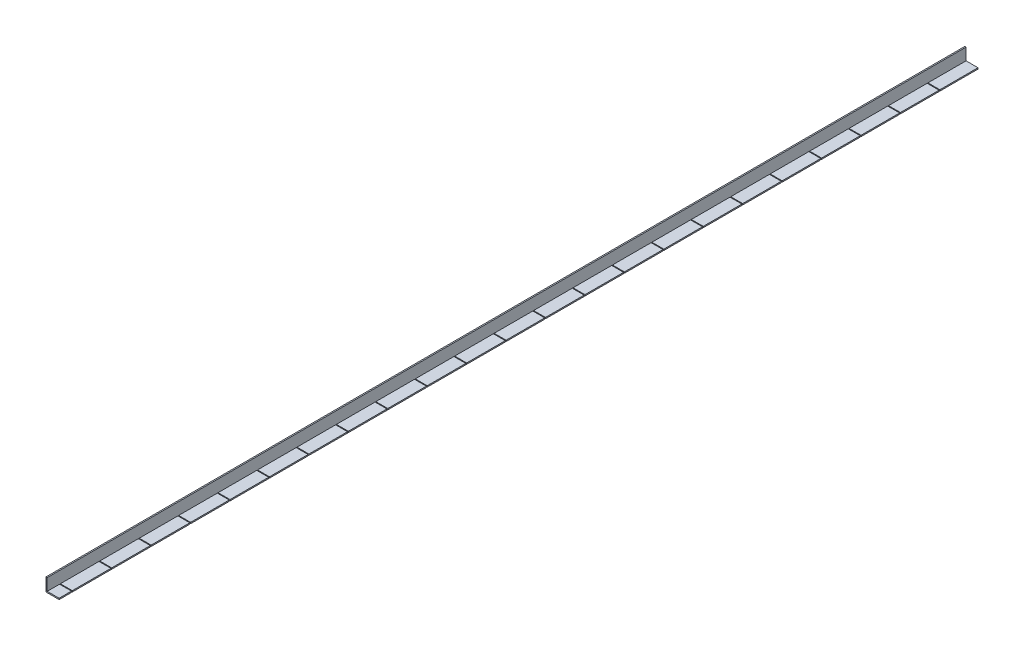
SolidWorks part; units mm, degrees
ref_plane "Front Plane" through (0, 0, 0) normal (0, 0, 1) x (1, 0, 0)
ref_plane "Top Plane" through (0, 0, 0) normal (0, 1, 0) x (1, 0, 0)
ref_plane "Right Plane" through (0, 0, 0) normal (1, 0, 0) x (0, 0, -1)
ref_plane "Plane1" through (0, 0, 0) normal (-1, 0, 0) x (0, -1, 0)
sketch "Sketch1" plane through (0, 0, 0) normal (-1, 0, 0) x (0, -1, 0)
  line L0 (-50.8, 0) -> (0, 0)
  line L1 (0, 0) -> (0, 3550.92)
  line L2 (0, 3550.92) -> (-50.8, 3550.92)
  line L3 (-50.8, 3550.92) -> (-50.8, 0)
extrude "Boss-Extrude1" add sketch "Sketch1" against normal blind 4.7625
sketch "Sketch2" plane through (4.7625, 0, 0) normal (1, 0, 0) x (0, 0, -1)
  line L0 (-3503.295, 4.7625) -> (-3503.295, 0)
  line L1 (-3503.295, 0) -> (-3550.92, 0)
  line L2 (-3550.92, 0) -> (-3550.92, 4.7625)
  line L3 (-3550.92, 4.7625) -> (-3503.295, 4.7625)
extrude "Boss-Extrude2" add sketch "Sketch2" along normal blind 46.0375
sketch "Sketch3" plane through (4.7625, 0, 0) normal (1, 0, 0) x (0, 0, -1)
  line L0 (-147.32, 0) -> (-147.32, 4.7625)
  line L1 (-147.32, 4.7625) -> (0, 4.7625)
  line L2 (0, 4.7625) -> (0, 0)
  line L3 (0, 0) -> (-147.32, 0)
extrude "Boss-Extrude3" add sketch "Sketch3" along normal blind 46.0375
sketch "Sketch4" plane through (4.7625, 0, 0) normal (1, 0, 0) x (0, 0, -1)
  line L0 (-3500.12, 0) -> (-3500.12, 4.7625)
  line L1 (-3500.12, 4.7625) -> (-3350.895, 4.7625)
  line L2 (-3350.895, 4.7625) -> (-3350.895, 0)
  line L3 (-3350.895, 0) -> (-3500.12, 0)
extrude "Boss-Extrude4" add sketch "Sketch4" along normal blind 46.0375
sketch "Sketch5" plane through (4.7625, 0, 0) normal (1, 0, 0) x (0, 0, -1)
  line L0 (-3347.72, 0) -> (-3347.72, 4.7625)
  line L1 (-3347.72, 4.7625) -> (-3198.495, 4.7625)
  line L2 (-3198.495, 4.7625) -> (-3198.495, 0)
  line L3 (-3198.495, 0) -> (-3347.72, 0)
extrude "Boss-Extrude5" add sketch "Sketch5" along normal blind 46.0375
sketch "Sketch6" plane through (4.7625, 0, 0) normal (1, 0, 0) x (0, 0, -1)
  line L0 (-3195.32, 0) -> (-3195.32, 4.7625)
  line L1 (-3195.32, 4.7625) -> (-3046.095, 4.7625)
  line L2 (-3046.095, 4.7625) -> (-3046.095, 0)
  line L3 (-3046.095, 0) -> (-3195.32, 0)
extrude "Boss-Extrude6" add sketch "Sketch6" along normal blind 46.0375
sketch "Sketch7" plane through (4.7625, 0, 0) normal (1, 0, 0) x (0, 0, -1)
  line L0 (-3042.92, 0) -> (-3042.92, 4.7625)
  line L1 (-3042.92, 4.7625) -> (-2893.695, 4.7625)
  line L2 (-2893.695, 4.7625) -> (-2893.695, 0)
  line L3 (-2893.695, 0) -> (-3042.92, 0)
extrude "Boss-Extrude7" add sketch "Sketch7" along normal blind 46.0375
sketch "Sketch8" plane through (4.7625, 0, 0) normal (1, 0, 0) x (0, 0, -1)
  line L0 (-2890.52, 0) -> (-2890.52, 4.7625)
  line L1 (-2890.52, 4.7625) -> (-2741.295, 4.7625)
  line L2 (-2741.295, 4.7625) -> (-2741.295, 0)
  line L3 (-2741.295, 0) -> (-2890.52, 0)
extrude "Boss-Extrude8" add sketch "Sketch8" along normal blind 46.0375
sketch "Sketch9" plane through (4.7625, 0, 0) normal (1, 0, 0) x (0, 0, -1)
  line L0 (-2738.12, 0) -> (-2738.12, 4.7625)
  line L1 (-2738.12, 4.7625) -> (-2588.895, 4.7625)
  line L2 (-2588.895, 4.7625) -> (-2588.895, 0)
  line L3 (-2588.895, 0) -> (-2738.12, 0)
extrude "Boss-Extrude9" add sketch "Sketch9" along normal blind 46.0375
sketch "Sketch10" plane through (4.7625, 0, 0) normal (1, 0, 0) x (0, 0, -1)
  line L0 (-2585.72, 0) -> (-2585.72, 4.7625)
  line L1 (-2585.72, 4.7625) -> (-2436.495, 4.7625)
  line L2 (-2436.495, 4.7625) -> (-2436.495, 0)
  line L3 (-2436.495, 0) -> (-2585.72, 0)
extrude "Boss-Extrude10" add sketch "Sketch10" along normal blind 46.0375
sketch "Sketch11" plane through (4.7625, 0, 0) normal (1, 0, 0) x (0, 0, -1)
  line L0 (-2433.32, 0) -> (-2433.32, 4.7625)
  line L1 (-2433.32, 4.7625) -> (-2284.095, 4.7625)
  line L2 (-2284.095, 4.7625) -> (-2284.095, 0)
  line L3 (-2284.095, 0) -> (-2433.32, 0)
extrude "Boss-Extrude11" add sketch "Sketch11" along normal blind 46.0375
sketch "Sketch12" plane through (4.7625, 0, 0) normal (1, 0, 0) x (0, 0, -1)
  line L0 (-2280.92, 0) -> (-2280.92, 4.7625)
  line L1 (-2280.92, 4.7625) -> (-2131.695, 4.7625)
  line L2 (-2131.695, 4.7625) -> (-2131.695, 0)
  line L3 (-2131.695, 0) -> (-2280.92, 0)
extrude "Boss-Extrude12" add sketch "Sketch12" along normal blind 46.0375
sketch "Sketch13" plane through (4.7625, 0, 0) normal (1, 0, 0) x (0, 0, -1)
  line L0 (-2128.52, 0) -> (-2128.52, 4.7625)
  line L1 (-2128.52, 4.7625) -> (-1979.295, 4.7625)
  line L2 (-1979.295, 4.7625) -> (-1979.295, 0)
  line L3 (-1979.295, 0) -> (-2128.52, 0)
extrude "Boss-Extrude13" add sketch "Sketch13" along normal blind 46.0375
sketch "Sketch14" plane through (4.7625, 0, 0) normal (1, 0, 0) x (0, 0, -1)
  line L0 (-1976.12, 0) -> (-1976.12, 4.7625)
  line L1 (-1976.12, 4.7625) -> (-1826.895, 4.7625)
  line L2 (-1826.895, 4.7625) -> (-1826.895, 0)
  line L3 (-1826.895, 0) -> (-1976.12, 0)
extrude "Boss-Extrude14" add sketch "Sketch14" along normal blind 46.0375
sketch "Sketch15" plane through (4.7625, 0, 0) normal (1, 0, 0) x (0, 0, -1)
  line L0 (-1823.72, 0) -> (-1823.72, 4.7625)
  line L1 (-1823.72, 4.7625) -> (-1674.495, 4.7625)
  line L2 (-1674.495, 4.7625) -> (-1674.495, 0)
  line L3 (-1674.495, 0) -> (-1823.72, 0)
extrude "Boss-Extrude15" add sketch "Sketch15" along normal blind 46.0375
sketch "Sketch16" plane through (4.7625, 0, 0) normal (1, 0, 0) x (0, 0, -1)
  line L0 (-1671.32, 0) -> (-1671.32, 4.7625)
  line L1 (-1671.32, 4.7625) -> (-1522.095, 4.7625)
  line L2 (-1522.095, 4.7625) -> (-1522.095, 0)
  line L3 (-1522.095, 0) -> (-1671.32, 0)
extrude "Boss-Extrude16" add sketch "Sketch16" along normal blind 46.0375
sketch "Sketch17" plane through (4.7625, 0, 0) normal (1, 0, 0) x (0, 0, -1)
  line L0 (-1518.92, 0) -> (-1518.92, 4.7625)
  line L1 (-1518.92, 4.7625) -> (-1369.695, 4.7625)
  line L2 (-1369.695, 4.7625) -> (-1369.695, 0)
  line L3 (-1369.695, 0) -> (-1518.92, 0)
extrude "Boss-Extrude17" add sketch "Sketch17" along normal blind 46.0375
sketch "Sketch18" plane through (4.7625, 0, 0) normal (1, 0, 0) x (0, 0, -1)
  line L0 (-1366.52, 0) -> (-1366.52, 4.7625)
  line L1 (-1366.52, 4.7625) -> (-1217.295, 4.7625)
  line L2 (-1217.295, 4.7625) -> (-1217.295, 0)
  line L3 (-1217.295, 0) -> (-1366.52, 0)
extrude "Boss-Extrude18" add sketch "Sketch18" along normal blind 46.0375
sketch "Sketch19" plane through (4.7625, 0, 0) normal (1, 0, 0) x (0, 0, -1)
  line L0 (-1214.12, 0) -> (-1214.12, 4.7625)
  line L1 (-1214.12, 4.7625) -> (-1064.895, 4.7625)
  line L2 (-1064.895, 4.7625) -> (-1064.895, 0)
  line L3 (-1064.895, 0) -> (-1214.12, 0)
extrude "Boss-Extrude19" add sketch "Sketch19" along normal blind 46.0375
sketch "Sketch20" plane through (4.7625, 0, 0) normal (1, 0, 0) x (0, 0, -1)
  line L0 (-1061.72, 0) -> (-1061.72, 4.7625)
  line L1 (-1061.72, 4.7625) -> (-912.495, 4.7625)
  line L2 (-912.495, 4.7625) -> (-912.495, 0)
  line L3 (-912.495, 0) -> (-1061.72, 0)
extrude "Boss-Extrude20" add sketch "Sketch20" along normal blind 46.0375
sketch "Sketch21" plane through (4.7625, 0, 0) normal (1, 0, 0) x (0, 0, -1)
  line L0 (-909.32, 0) -> (-909.32, 4.7625)
  line L1 (-909.32, 4.7625) -> (-760.095, 4.7625)
  line L2 (-760.095, 4.7625) -> (-760.095, 0)
  line L3 (-760.095, 0) -> (-909.32, 0)
extrude "Boss-Extrude21" add sketch "Sketch21" along normal blind 46.0375
sketch "Sketch22" plane through (4.7625, 0, 0) normal (1, 0, 0) x (0, 0, -1)
  line L0 (-756.92, 0) -> (-756.92, 4.7625)
  line L1 (-756.92, 4.7625) -> (-607.695, 4.7625)
  line L2 (-607.695, 4.7625) -> (-607.695, 0)
  line L3 (-607.695, 0) -> (-756.92, 0)
extrude "Boss-Extrude22" add sketch "Sketch22" along normal blind 46.0375
sketch "Sketch23" plane through (4.7625, 0, 0) normal (1, 0, 0) x (0, 0, -1)
  line L0 (-604.52, 0) -> (-604.52, 4.7625)
  line L1 (-604.52, 4.7625) -> (-455.295, 4.7625)
  line L2 (-455.295, 4.7625) -> (-455.295, 0)
  line L3 (-455.295, 0) -> (-604.52, 0)
extrude "Boss-Extrude23" add sketch "Sketch23" along normal blind 46.0375
sketch "Sketch24" plane through (4.7625, 0, 0) normal (1, 0, 0) x (0, 0, -1)
  line L0 (-452.12, 0) -> (-452.12, 4.7625)
  line L1 (-452.12, 4.7625) -> (-302.895, 4.7625)
  line L2 (-302.895, 4.7625) -> (-302.895, 0)
  line L3 (-302.895, 0) -> (-452.12, 0)
extrude "Boss-Extrude24" add sketch "Sketch24" along normal blind 46.0375
sketch "Sketch25" plane through (4.7625, 0, 0) normal (1, 0, 0) x (0, 0, -1)
  line L0 (-299.72, 0) -> (-299.72, 4.7625)
  line L1 (-299.72, 4.7625) -> (-150.495, 4.7625)
  line L2 (-150.495, 4.7625) -> (-150.495, 0)
  line L3 (-150.495, 0) -> (-299.72, 0)
extrude "Boss-Extrude25" add sketch "Sketch25" along normal blind 46.0375
